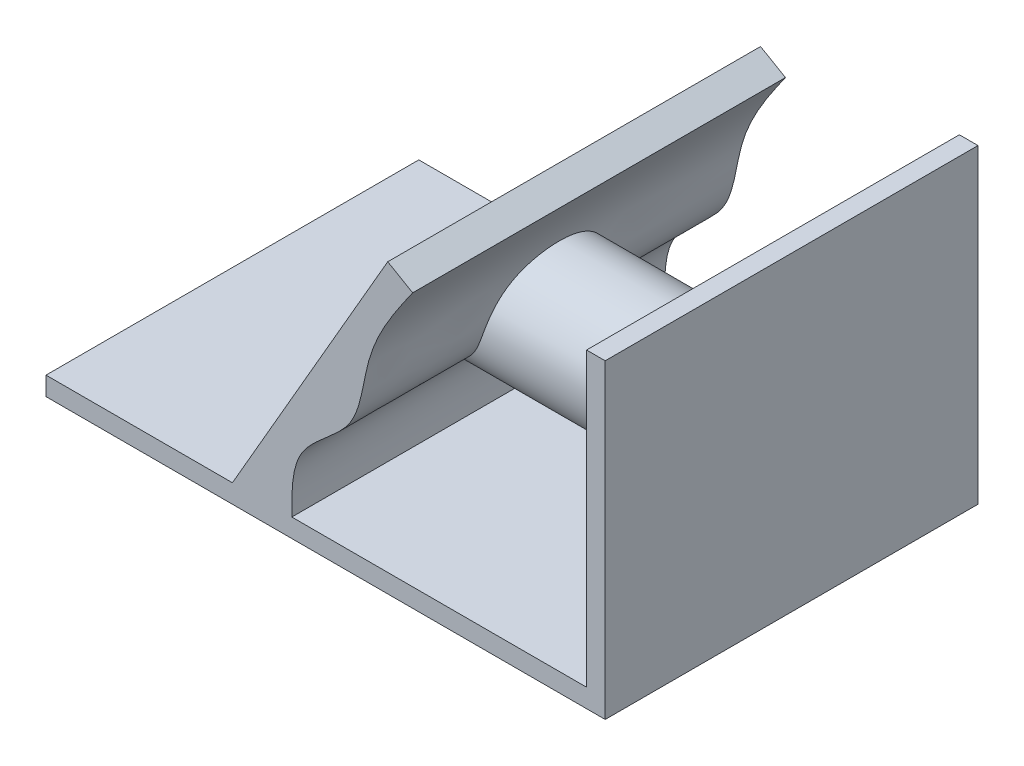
SolidWorks part; units mm, degrees
ref_plane "Front Plane" through (0, 0, 0) normal (0, 0, 1) x (1, 0, 0)
ref_plane "Top Plane" through (0, 0, 0) normal (0, 1, 0) x (1, 0, 0)
ref_plane "Right Plane" through (0, 0, 0) normal (1, 0, 0) x (0, 0, -1)
sketch "Sketch1" plane through (0, 0, 0) normal (0, 0, 1) x (1, 0, 0)
  line L0 (0, 0) -> (-90, 0)
  line L1 (0, 0) -> (0, 50)
  dimension "D1" = 50
  dimension "D2" = 90
extrude "Extrude-Thin1" add sketch "Sketch1" along normal mid plane 60 thin
sketch "Sketch7" plane through (0, 0, 0) normal (0, 0, 1) x (1, 0, 0)
  line L0 (-60, 3) -> (-35, 46.3013)
  line L2 (-90, 3) -> (-3, 3) construction
  line L3 (-35, 46.3013) -> (-30.9853, 43.9834)
  line L5 (-50.4342, 3) -> (-60, 3)
  spline S0 degree 3 poles (-30.9853, 43.9834) (-33.8356, 39.9154) (-38.7683, 32.8753) (-39.3841, 19.5912) (-50.5185, 13.9411) (-50.4608, 6.4471) (-50.4342, 3) knots 0 0 0 0 0.316678 0.548049 0.792112 1 1 1 1
  dimension "D1" = 60
  dimension "D3" = 30
  dimension "D4" = 50
extrude "Extrude2" add sketch "Sketch7" along normal mid plane 60
sketch "Sketch8" plane through (-3, 0, 0) normal (-1, 0, 0) x (0, 0, 1)
  line L0 (0, 46.3013) -> (0, 3) construction
  line L1 (30, 46.3013) -> (-30, 46.3013) construction
  line L2 (30, 3) -> (-30, 3) construction
  circle A0 centre (0, 23) radius 10
  dimension "D1" = 20
  dimension "D2" = 20
extrude "Extrude3" add sketch "Sketch8" along normal up to surface (37.0054 mm away)
